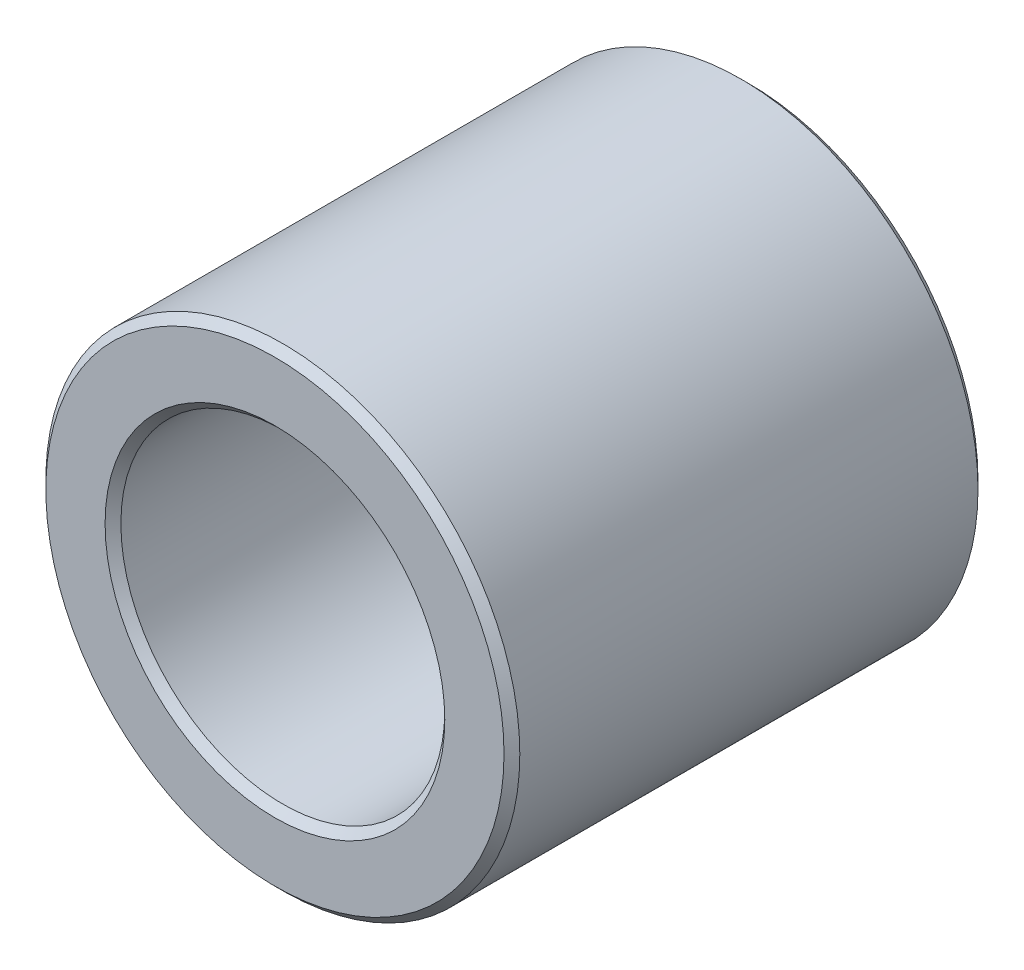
SolidWorks part; units mm, degrees
ref_plane "Front Plane" through (0, 0, 0) normal (0, 0, 1) x (1, 0, 0)
ref_plane "Top Plane" through (0, 0, 0) normal (0, 1, 0) x (1, 0, 0)
ref_plane "Right Plane" through (0, 0, 0) normal (1, 0, 0) x (0, 0, -1)
sketch "Sketch1" plane through (0, 0, 0) normal (0, 0, 1) x (1, 0, 0)
  circle A0 centre (0, 0) radius 6
  circle A1 centre (0, 0) radius 4.1
  dimension "D1" = 12
  dimension "D2" = 8.2
extrude "Boss-Extrude2" add sketch "Sketch1" along normal mid plane 12
chamfer "Chamfer3" distance 0.2 angle 45 4 edges at (6, 0, 6) (6, 0, -6) (4.1, 0, -6) (4.1, 0, 6)
